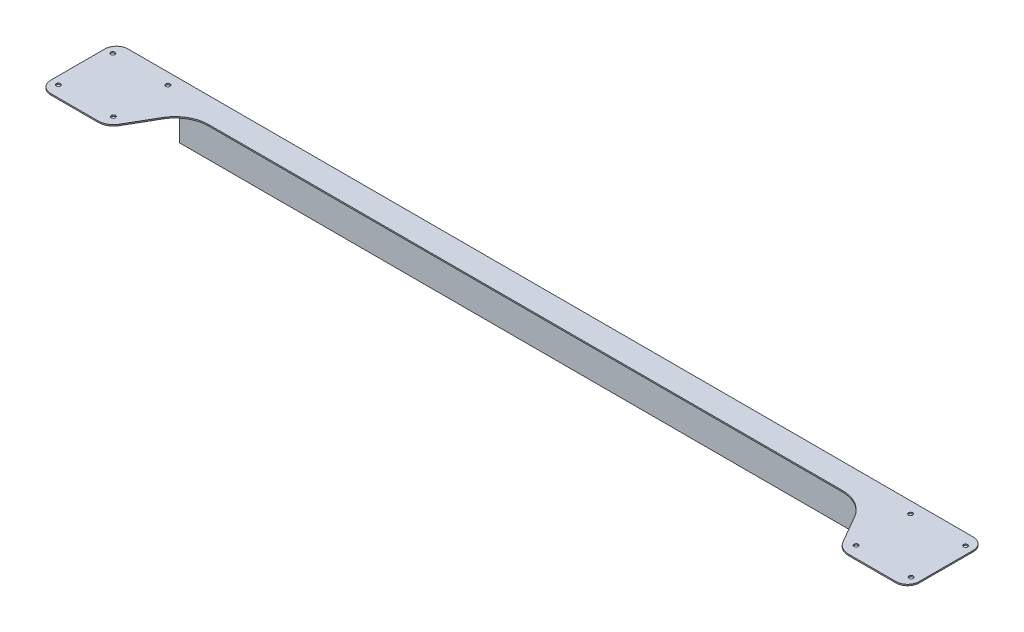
SolidWorks part; units mm, degrees
ref_plane "Front Plane" through (0, 0, 0) normal (0, 0, 1) x (1, 0, 0)
ref_plane "Top Plane" through (0, 0, 0) normal (0, 1, 0) x (1, 0, 0)
ref_plane "Right Plane" through (0, 0, 0) normal (1, 0, 0) x (0, 0, -1)
sketch "sk inner beam" plane through (0, 0, 0) normal (0, 1, 0) x (1, 0, 0)
  line L0 (-3904.5303, 3910.1183) -> (-3915.7063, 3910.1183)
  line L2 (3904.5303, -3910.1183) -> (3915.7063, -3910.1183)
  line L4 (3910.1183, -3910.1183) -> (-3910.1183, 3910.1183)
  line L6 (-3263.8528, -3926.7169) -> (3263.8528, -3926.7169)
  line L7 (-3263.8528, -3926.7169) -> (-3263.8528, -4622.4615)
  line L8 (-3263.8528, -4622.4615) -> (3263.8528, -4622.4615)
  line L9 (3263.8528, -3926.7169) -> (3263.8528, -4622.4615)
  line L11 (-3263.8528, 4592.7571) -> (3263.8528, 4592.7571)
  line L12 (-3263.8528, 4592.7571) -> (-3263.8528, 3926.7169)
  line L13 (-3263.8528, 3926.7169) -> (3263.8528, 3926.7169)
  line L14 (3263.8528, 4592.7571) -> (3263.8528, 3926.7169)
  line L15 (-5348.8544, 3231.2138) -> (-3940.1278, 3231.2138)
  line L16 (-5348.8544, 3231.2138) -> (-5348.8544, -3231.2138)
  line L17 (-5348.8544, -3231.2138) -> (-3940.1278, -3231.2138)
  line L18 (-3940.1278, 3231.2138) -> (-3940.1278, -3231.2138)
  point P4 (3910.1183, -3910.1183)
  point P7 (-3563.9961, -3910.1183)
  point P8 (0, 0)
  point P13 (3563.9961, 3910.1183)
  point P22 (-3910.1183, -3531.3571)
  line B0 (-3678.2961, 4288.8795) -> (-4141.9405, 4288.8795)
  line B1 (-4256.2405, 4174.5795) -> (-4256.2405, 3645.6571)
  line B2 (-3563.9961, 3645.6571) -> (-3563.9961, 4174.5795)
  line B3 (-4141.9405, 3531.3571) -> (-3678.2961, 3531.3571)
  line B4 (3678.2961, 3531.3571) -> (4141.9405, 3531.3571)
  line B5 (4256.2405, 3645.6571) -> (4256.2405, 4174.5795)
  line B6 (3563.9961, 4174.5795) -> (3563.9961, 3645.6571)
  line B7 (4141.9405, 4288.8795) -> (3678.2961, 4288.8795)
  line B8 (-3678.2961, -3531.3571) -> (-4141.9405, -3531.3571)
  line B9 (-4256.2405, -3645.6571) -> (-4256.2405, -4174.5795)
  line B10 (-3563.9961, -4174.5795) -> (-3563.9961, -3645.6571)
  line B11 (-4141.9405, -4288.8795) -> (-3678.2961, -4288.8795)
  line B12 (4256.2405, -4174.5795) -> (4256.2405, -3645.6571)
  line B13 (3678.2961, -4288.8795) -> (4141.9405, -4288.8795)
  line B14 (4141.9405, -3531.3571) -> (3678.2961, -3531.3571)
  line B15 (3563.9961, -3645.6571) -> (3563.9961, -4174.5795)
  line B16 (-3904.5303, 3765.3383) -> (-3904.5303, 4054.8983)
  line B17 (-4094.5223, 3732.0643) -> (-3725.7143, 3732.0643)
  line B18 (-3725.7143, 4088.1723) -> (-4094.5223, 4088.1723)
  line B19 (-3915.7063, 4054.8983) -> (-3915.7063, 3765.3383)
  line B20 (-3725.7143, -3732.0643) -> (-4094.5223, -3732.0643)
  line B21 (-3915.7063, -3765.3383) -> (-3915.7063, -4054.8983)
  line B22 (4094.5223, -3732.0643) -> (3725.7143, -3732.0643)
  line B23 (3904.5303, -3765.3383) -> (3904.5303, -4054.8983)
  line B24 (4094.5223, 4088.1723) -> (3725.7143, 4088.1723)
  line B25 (3904.5303, 4054.8983) -> (3904.5303, 3765.3383)
  line B26 (3725.7143, 3732.0643) -> (4094.5223, 3732.0643)
  line B27 (-4094.5223, -4088.1723) -> (-3725.7143, -4088.1723)
  line B28 (3725.7143, -4088.1723) -> (4094.5223, -4088.1723)
  line B29 (-3904.5303, -4054.8983) -> (-3904.5303, -3765.3383)
  line B30 (3915.7063, -4054.8983) -> (3915.7063, -3765.3383)
  line B31 (3915.7063, 3765.3383) -> (3915.7063, 4054.8983)
  circle B32 centre (-4180.0405, 4177.1195) radius 19.8438
  circle B33 centre (-3640.1961, 4177.1195) radius 19.8438
  circle B34 centre (-4180.0405, 3643.1171) radius 19.8437
  circle B35 centre (-3640.1961, 3643.1171) radius 19.8438
  arc B36 (-3678.2961, 3531.3571) -> (-3563.9961, 3645.6571) centre (-3678.2961, 3645.6571) ccw
  arc B37 (-4256.2405, 3645.6571) -> (-4141.9405, 3531.3571) centre (-4141.9405, 3645.6571) ccw
  arc B38 (-3563.9961, 4174.5795) -> (-3678.2961, 4288.8795) centre (-3678.2961, 4174.5795) ccw
  arc B39 (4141.9405, 3531.3571) -> (4256.2405, 3645.6571) centre (4141.9405, 3645.6571) ccw
  circle B40 centre (4180.0405, 3643.1171) radius 19.8437
  circle B41 centre (3640.1961, 3643.1171) radius 19.8438
  circle B42 centre (3640.1961, 4177.1195) radius 19.8438
  circle B43 centre (4180.0405, 4177.1195) radius 19.8438
  arc B44 (3563.9961, 3645.6571) -> (3678.2961, 3531.3571) centre (3678.2961, 3645.6571) ccw
  arc B45 (4256.2405, 4174.5795) -> (4141.9405, 4288.8795) centre (4141.9405, 4174.5795) ccw
  arc B46 (3678.2961, 4288.8795) -> (3563.9961, 4174.5795) centre (3678.2961, 4174.5795) ccw
  arc B47 (-4141.9405, 4288.8795) -> (-4256.2405, 4174.5795) centre (-4141.9405, 4174.5795) ccw
  arc B48 (-4141.9405, -3531.3571) -> (-4256.2405, -3645.6571) centre (-4141.9405, -3645.6571) ccw
  circle B49 centre (-4180.0405, -3643.1171) radius 19.8437
  circle B50 centre (-4180.0405, -4177.1195) radius 19.8437
  arc B51 (-4256.2405, -4174.5795) -> (-4141.9405, -4288.8795) centre (-4141.9405, -4174.5795) ccw
  circle B52 centre (-3640.1961, -4177.1195) radius 19.8437
  circle B53 centre (-3640.1961, -3643.1171) radius 19.8438
  arc B54 (-3563.9961, -3645.6571) -> (-3678.2961, -3531.3571) centre (-3678.2961, -3645.6571) ccw
  arc B55 (-3678.2961, -4288.8795) -> (-3563.9961, -4174.5795) centre (-3678.2961, -4174.5795) ccw
  circle B56 centre (4180.0405, -3643.1171) radius 19.8437
  arc B57 (4256.2405, -3645.6571) -> (4141.9405, -3531.3571) centre (4141.9405, -3645.6571) ccw
  circle B58 centre (3640.1961, -3643.1171) radius 19.8438
  circle B59 centre (3640.1961, -4177.1195) radius 19.8437
  circle B60 centre (4180.0405, -4177.1195) radius 19.8437
  arc B61 (4141.9405, -4288.8795) -> (4256.2405, -4174.5795) centre (4141.9405, -4174.5795) ccw
  arc B62 (3678.2961, -3531.3571) -> (3563.9961, -3645.6571) centre (3678.2961, -3645.6571) ccw
  arc B63 (3563.9961, -4174.5795) -> (3678.2961, -4288.8795) centre (3678.2961, -4174.5795) ccw
  dimension "D1" = 300.1433
  dimension "D2" = 16.5986
  dimension "D3" = 300.1433
  dimension "D4" = 16.5986
  dimension "D5" = 30.0095
  dimension "D6" = 300.1433
  dimension "D7" = 300.1433
sketch_block_instance "Inner beam 4corner-1"
sketch_block "Inner beam 4corner"
sketch "Sketch2" plane through (0, 0, 0) normal (0, 1, 0) x (1, 0, 0)
  line L0 (-3678.2961, -3531.3571) -> (-4141.9405, -3531.3571) construction
  line L1 (-4141.9405, -3531.3571) -> (4141.9405, -3531.3571)
  line L2 (-4256.2405, -3645.6571) -> (-4256.2405, -4174.5795)
  line L3 (-4141.9405, -4288.8795) -> (-3678.2961, -4288.8795)
  line L4 (4256.2405, -3645.6571) -> (4256.2405, -4174.5795)
  line L5 (-4141.9405, -4288.8795) -> (-3678.2961, -4288.8795) construction
  line L6 (-4256.2405, -3645.6571) -> (-4256.2405, -4174.5795) construction
  line L7 (4256.2405, -4174.5795) -> (4256.2405, -3645.6571) construction
  line L8 (3678.2961, -4288.8795) -> (4141.9405, -4288.8795)
  line L13 (-3546.3138, -4212.6795) -> (-3390.5535, -3942.8948)
  line L14 (-3104.5919, -3777.7948) -> (3104.592, -3777.7948)
  line L15 (3390.5535, -3942.8948) -> (3546.3139, -4212.6795)
  line L20 (0, -3777.7948) -> (0, -3531.3571) construction
  arc A0 (4141.9405, -4288.8795) -> (4256.2405, -4174.5795) centre (4141.9405, -4174.5795) ccw
  arc A1 (4141.9405, -3531.3571) -> (4256.2405, -3645.6571) centre (4141.9405, -3645.6571) cw
  arc A2 (-4256.2405, -4174.5795) -> (-4141.9405, -4288.8795) centre (-4141.9405, -4174.5795) ccw
  arc A3 (-4141.9405, -3531.3571) -> (-4256.2405, -3645.6571) centre (-4141.9405, -3645.6571) ccw
  arc A4 (3678.2961, -4288.8795) -> (3546.3139, -4212.6795) centre (3678.2961, -4136.4795) cw
  arc A5 (-3678.2961, -4288.8795) -> (-3546.3138, -4212.6795) centre (-3678.2961, -4136.4795) ccw
  arc A6 (3104.592, -3777.7948) -> (3390.5535, -3942.8948) centre (3104.592, -4107.9948) cw
  arc A7 (-3390.5535, -3942.8948) -> (-3104.5919, -3777.7948) centre (-3104.5919, -4107.9948) cw
  arc A8 (-3678.2961, -4288.8795) -> (-3563.9961, -4174.5795) centre (-3678.2961, -4174.5795) ccw construction
  arc A9 (3563.9961, -4174.5795) -> (3678.2961, -4288.8795) centre (3678.2961, -4174.5795) ccw construction
  circle A11 centre (-4180.0405, -3643.1171) radius 20.6375
  circle A12 centre (-4180.0405, -4177.1195) radius 20.6375
  circle A13 centre (-3640.1961, -3643.1171) radius 20.6375
  circle A14 centre (-3640.1961, -4177.1195) radius 20.6375
  circle A15 centre (3640.1961, -3643.1171) radius 20.6375
  circle A16 centre (4180.0405, -3643.1171) radius 20.6375
  circle A17 centre (4180.0405, -4177.1195) radius 20.6375
  circle A18 centre (3640.1961, -4177.1195) radius 20.6375
  circle A19 centre (3640.1961, -3643.1171) radius 19.8438 construction
  circle A20 centre (4180.0405, -3643.1171) radius 19.8437 construction
  circle A21 centre (4180.0405, -4177.1195) radius 19.8437 construction
  circle A22 centre (3640.1961, -4177.1195) radius 19.8438 construction
  circle A23 centre (-4180.0405, -3643.1171) radius 19.8437 construction
  circle A24 centre (-3640.1961, -3643.1171) radius 19.8438 construction
  circle A25 centre (-3640.1961, -4177.1195) radius 19.8438 construction
  circle A26 centre (-4180.0405, -4177.1195) radius 19.8437 construction
  circle A29 centre (-3263.8528, -3926.7169) radius 88.9 construction
  point P32 (0, -3654.5759)
  point P77 (0, -3531.3571)
  dimension "D1" = 114.3
  dimension "D2" = 152.4
  dimension "D5" = 330.2
  dimension "D6" = 177.8
  dimension "D7" = 41.275
  dimension "D8" = 41.275
  dimension "D9" = 41.275
  dimension "D10" = 41.275
  dimension "D11" = 41.275
  dimension "D12" = 41.275
  dimension "D13" = 41.275
  dimension "D14" = 41.275
  dimension "D3" = 60
  dimension "D4" = 60
extrude "Boss-Extrude1" add sketch "Sketch2" along normal blind 12.7
sketch "Sketch3" plane through (0, 0, 0) normal (0, 1, 0) x (1, 0, 0)
  line L0 (0, -3777.7948) -> (0, -3531.3571) construction
  line L1 (-3513.1961, -3652.1947) -> (3513.1961, -3652.1947)
  line L2 (-3513.1961, -3652.1947) -> (-3513.1961, -3656.9572)
  line L3 (-3513.1961, -3656.9572) -> (3513.1961, -3656.9572)
  line L4 (3513.1961, -3652.1947) -> (3513.1961, -3656.9572)
  line L5 (-3563.9961, -4174.5795) -> (-3563.9961, -3645.6571) construction
  point P5 (0, -3652.1947)
  point P8 (-3513.1961, -3654.5759)
  dimension "D1" = 4.7625
  dimension "D2" = 50.8
extrude "Boss-Extrude2" add sketch "Sketch3" against normal blind 406.4
sketch "Sketch4" [suppressed] plane through (0, 0, 0) normal (0, 1, 0) x (1, 0, 0)
  line L0 (-3678.2961, 4288.8795) -> (-4141.9405, 4288.8795) construction
  line L1 (-4141.9405, 4288.8795) -> (-3678.2961, 4288.8795)
  line L2 (-4256.2405, 4174.5795) -> (-4256.2405, 3645.6571)
  line L3 (-4141.9405, -4288.8795) -> (-3678.2961, -4288.8795)
  line L4 (-3563.9961, 4174.5795) -> (-3563.9961, -4174.5795)
  line L5 (-4256.2405, 4174.5795) -> (-4256.2405, 3645.6571) construction
  line L6 (-3563.9961, 3645.6571) -> (-3563.9961, 4174.5795) construction
  line L7 (-4141.9405, -4288.8795) -> (-3678.2961, -4288.8795) construction
  line L8 (-4256.2405, -3645.6571) -> (-4256.2405, -4174.5795)
  line L9 (-4180.0405, 3513.6749) -> (-3987.2723, 3402.38)
  line L10 (-3822.1723, 3116.4185) -> (-3822.1723, -3116.4185)
  line L11 (-3987.2723, -3402.38) -> (-4180.0405, -3513.6749)
  line L12 (-3822.1723, 0) -> (-3571.9336, 0) construction
  line L13 (-4141.9405, 3531.3571) -> (-3678.2961, 3531.3571) construction
  line L14 (-3699.4342, 3480.5571) -> (-3694.6717, 3480.5571) construction
  line L15 (-3699.4342, 3480.5571) -> (-3699.4342, -3480.5571) construction
  line L16 (-3699.4342, -3480.5571) -> (-3694.6717, -3480.5571) construction
  line L17 (-3694.6717, 3480.5571) -> (-3694.6717, -3480.5571) construction
  arc A0 (-3678.2961, 4288.8795) -> (-3563.9961, 4174.5795) centre (-3678.2961, 4174.5795) cw
  arc A1 (-4141.9405, 4288.8795) -> (-4256.2405, 4174.5795) centre (-4141.9405, 4174.5795) ccw
  arc A2 (-3678.2961, -4288.8795) -> (-3563.9961, -4174.5795) centre (-3678.2961, -4174.5795) ccw
  arc A3 (-4256.2405, -4174.5795) -> (-4141.9405, -4288.8795) centre (-4141.9405, -4174.5795) ccw
  arc A5 (-4256.2405, -3645.6571) -> (-4180.0405, -3513.6749) centre (-4103.8405, -3645.6571) cw
  arc A6 (-4256.2405, 3645.6571) -> (-4180.0405, 3513.6749) centre (-4103.8405, 3645.6571) ccw
  arc A7 (-3822.1723, -3116.4185) -> (-3987.2723, -3402.38) centre (-4152.3723, -3116.4185) cw
  arc A8 (-3987.2723, 3402.38) -> (-3822.1723, 3116.4185) centre (-4152.3723, 3116.4185) cw
  arc A11 (-4141.9405, -3531.3571) -> (-4256.2405, -3645.6571) centre (-4141.9405, -3645.6571) ccw construction
  arc A12 (-4256.2405, 3645.6571) -> (-4141.9405, 3531.3571) centre (-4141.9405, 3645.6571) ccw construction
  circle A14 centre (-3940.1278, -3231.2138) radius 88.9 construction
  circle A15 centre (-4180.0405, -3643.1171) radius 20.6375
  circle A16 centre (-4180.0405, -4177.1195) radius 20.6375
  circle A17 centre (-3640.1961, -3643.1171) radius 20.6375
  circle A18 centre (-3640.1961, -4177.1195) radius 20.6375
  circle A19 centre (-4180.0405, -3643.1171) radius 19.8437 construction
  circle A20 centre (-3640.1961, -3643.1171) radius 19.8438 construction
  circle A21 centre (-4180.0405, -4177.1195) radius 19.8437 construction
  circle A22 centre (-3640.1961, -4177.1195) radius 19.8438 construction
  circle A23 centre (-4180.0405, 4177.1195) radius 20.6375
  circle A24 centre (-3640.1961, 4177.1195) radius 20.6375
  circle A25 centre (-4180.0405, 3643.1171) radius 20.6375
  circle A26 centre (-3640.1961, 3643.1171) radius 20.6375
  circle A27 centre (-4180.0405, 4177.1195) radius 19.8437 construction
  circle A28 centre (-3640.1961, 4177.1195) radius 19.8438 construction
  circle A29 centre (-3640.1961, 3643.1171) radius 19.8438 construction
  circle A30 centre (-4180.0405, 3643.1171) radius 19.8437 construction
  point P34 (-3822.1723, 0)
  point P35 (-3563.9961, 0)
  point P44 (-3697.053, 0)
  point P51 (-3697.053, 3480.5571)
  point P52 (-3694.6717, 0)
  dimension "D1" = 114.3
  dimension "D3" = 152.4
  dimension "D4" = 330.2
  dimension "D2" = 177.8
  dimension "D9" = 41.275
  dimension "D10" = 41.275
  dimension "D11" = 41.275
  dimension "D12" = 41.275
  dimension "D13" = 41.275
  dimension "D14" = 41.275
  dimension "D15" = 41.275
  dimension "D16" = 41.275
  dimension "D5" = 60
  dimension "D6" = 60
  dimension "D7" = 4.7625
  dimension "D8" = 50.8
extrude "Boss-Extrude3" [suppressed] add sketch "Sketch4" along normal blind 12.7
sketch "Sketch5" [suppressed] plane through (0, 0, 0) normal (0, 1, 0) x (1, 0, 0)
  line L1 (-3699.4342, 3480.5571) -> (-3694.6717, 3480.5571)
  line L2 (-3699.4342, 3480.5571) -> (-3699.4342, -3480.5571)
  line L3 (-3699.4342, -3480.5571) -> (-3694.6717, -3480.5571)
  line L4 (-3694.6717, 3480.5571) -> (-3694.6717, -3480.5571)
extrude "Boss-Extrude4" [suppressed] add sketch "Sketch5" against normal blind 406.4
